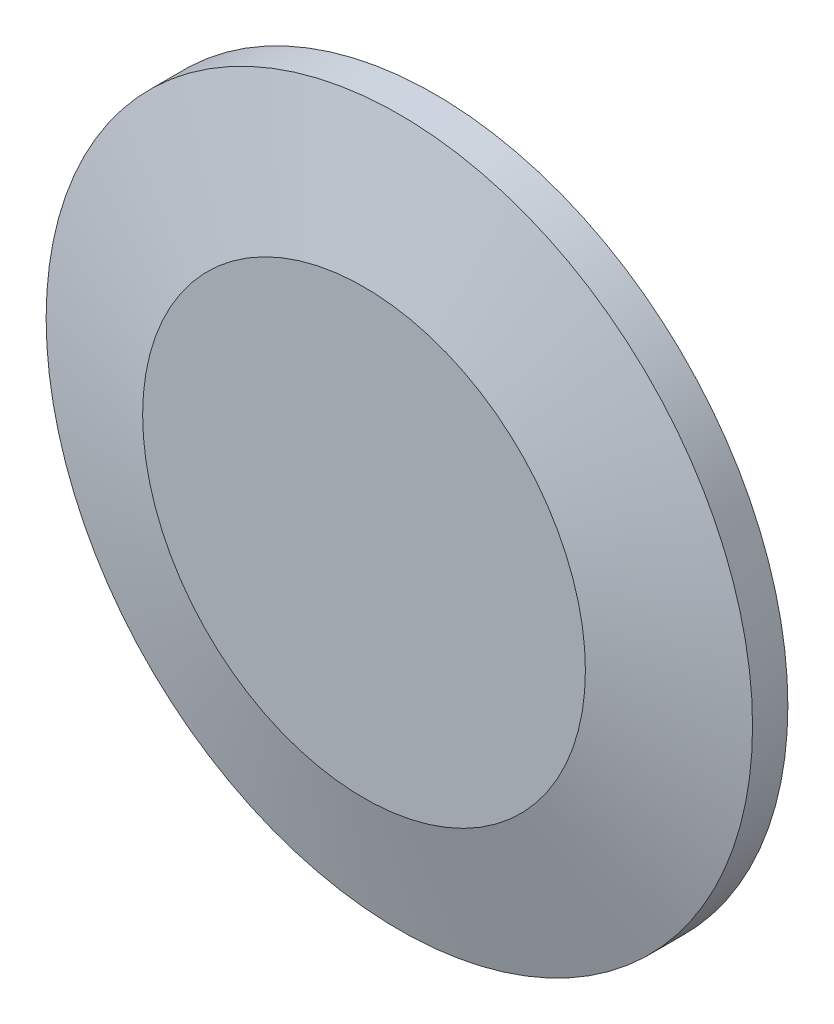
SolidWorks part; units mm, degrees
ref_plane "Front Plane" through (0, 0, 0) normal (0, 0, 1) x (1, 0, 0)
ref_plane "Top Plane" through (0, 0, 0) normal (0, 1, 0) x (1, 0, 0)
ref_plane "Right Plane" through (0, 0, 0) normal (1, 0, 0) x (0, 0, -1)
sketch "Sketch1" plane through (0, 0, 0) normal (0, 0, 1) x (1, 0, 0)
  circle A0 centre (0, 0) radius 25.4
extrude "Boss-Extrude1" add sketch "Sketch1" along normal blind 2.54
sketch "Sketch2" plane through (0, 0, 2.54) normal (0, 0, 1) x (1, 0, 0)
  circle A1 centre (0, 0) radius 25.4
  circle A2 centre (0, 0) radius 25.4
  dimension "D1" = 0
extrude "Boss-Extrude2" add sketch "Sketch2" along normal blind 2.54 draft 75
sketch "Sketch4" plane through (0, 0, 0) normal (0, 0, -1) x (-1, 0, 0)
  circle A0 centre (0, 0) radius 2.54
extrude "Cut-Extrude2" cut sketch "Sketch4" against normal blind 2.54
